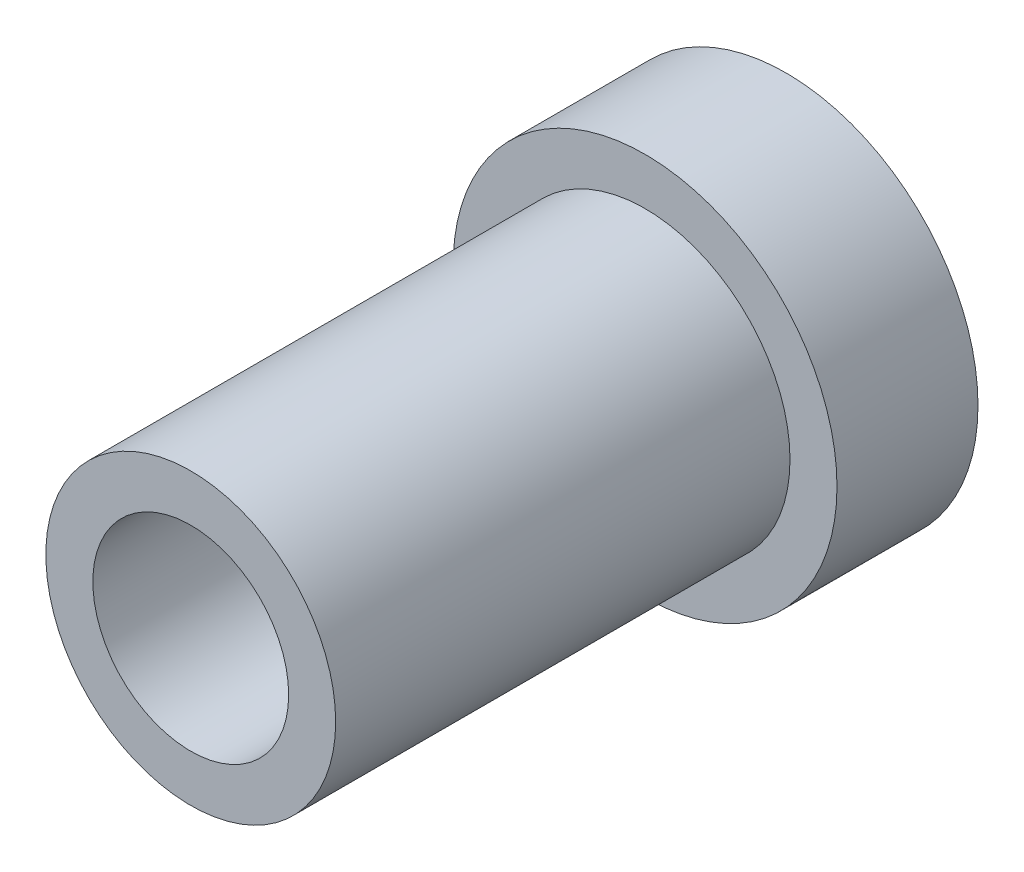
SolidWorks part; units mm, degrees
ref_plane "Front Plane" through (0, 0, 0) normal (0, 0, 1) x (1, 0, 0)
ref_plane "Top Plane" through (0, 0, 0) normal (0, 1, 0) x (1, 0, 0)
ref_plane "Right Plane" through (0, 0, 0) normal (1, 0, 0) x (0, 0, -1)
sketch "Sketch1" plane through (0, 0, 0) normal (0, 0, 1) x (1, 0, 0)
  circle A0 centre (0, 0) radius 6.223
  dimension "D1" = 12.446
extrude "Extrude1" add sketch "Sketch1" along normal blind 4.572
sketch "Sketch2" plane through (0, 0, 4.572) normal (0, 0, 1) x (1, 0, 0)
  circle A0 centre (0, 0) radius 4.699
  dimension "D1" = 9.398
extrude "Extrude2" add sketch "Sketch2" along normal blind 14.732
sketch "Sketch3" plane through (0, 0, 0) normal (0, 0, -1) x (-1, 0, 0)
  circle A0 centre (0, 0) radius 2.286
  dimension "D1" = 4.572
extrude "Cut-Extrude1" cut sketch "Sketch3" against normal through all
sketch "Sketch4" plane through (0, 0, 19.304) normal (0, 0, 1) x (1, 0, 0)
  circle A0 centre (0, 0) radius 3.175
  dimension "D1" = 6.35
extrude "Cut-Extrude2" cut sketch "Sketch4" against normal blind 7.112
